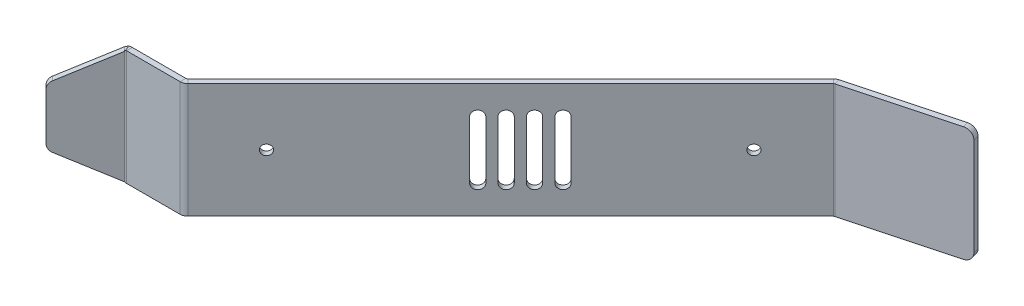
SolidWorks part; units mm, degrees
ref_plane "Plan de face" through (0, 0, 0) normal (0, 0, 1) x (1, 0, 0)
ref_plane "Plan de dessus" through (0, 0, 0) normal (0, 1, 0) x (1, 0, 0)
ref_plane "Plan de droite" through (0, 0, 0) normal (1, 0, 0) x (0, 0, -1)
sketch "Esquisse1" plane through (0, 0, 0) normal (0, 0, 1) x (1, 0, 0)
  line L0 (20, 45) -> (20, -5) construction
  line L1 (20, 0) -> (237, 0)
  line L2 (0, 11.8541) -> (0, 28.1459)
  line L3 (20, 40) -> (237, 40)
  line L4 (240, 3) -> (240, 37)
  line L5 (40, 45) -> (40, -5) construction
  line L6 (200, 45) -> (200, -5) construction
  line L7 (55, 20) -> (185, 20) construction
  line L8 (60, 25) -> (60, 15) construction
  line L9 (180, 25) -> (180, 15) construction
  line L10 (-7.2869, 10) -> (4.241, 10) construction
  line L11 (-7.2869, 30) -> (4.241, 30) construction
  line L12 (1.6584, 9.1708) -> (20, 0)
  line L13 (1.6584, 30.8292) -> (20, 40)
  circle A0 centre (60, 20) radius 1.75
  circle A1 centre (180, 20) radius 1.75
  arc A2 (1.6584, 30.8292) -> (0, 28.1459) centre (3, 28.1459) ccw
  arc A3 (1.6584, 9.1708) -> (0, 11.8541) centre (3, 11.8541) cw
  arc A4 (237, 0) -> (240, 3) centre (237, 3) ccw
  arc A5 (237, 40) -> (240, 37) centre (237, 37) cw
  point P30 (0, 30)
  point P33 (0, 10)
  dimension "D1" = 3
extrude "Extrusion1" add sketch "Esquisse1" along normal blind 2
sketch "Esquisse2" plane through (0, 0, 2) normal (0, 0, 1) x (1, 0, 0)
  line L0 (20, 40) -> (20, 0)
sketch "Esquisse10" plane through (0, 0, 0) normal (0, 0, -1) x (-1, 0, 0)
  line L0 (-179.7363, 30) -> (-88.1801, 30) construction
  line L1 (-176.4242, 10) -> (-88.1801, 10) construction
  line L2 (-133, 45.1957) -> (-133, -8.981) construction
  line L3 (-237, 40) -> (-20, 40) construction
  line L4 (-20, 0) -> (-237, 0) construction
  line L5 (-128, 30) -> (-128, 10)
  line L6 (-135, 30) -> (-135, 10)
  line L7 (-131, 30) -> (-131, 10)
  line L8 (-124, 30) -> (-124, 10)
  line L9 (-121, 30) -> (-121, 10)
  line L10 (-117, 30) -> (-117, 10)
  line L11 (-114, 30) -> (-114, 10)
  line L12 (-110, 30) -> (-110, 10)
  circle A0 centre (-180, 20) radius 1.75 construction
  arc A1 (-135, 30) -> (-131, 30) centre (-133, 30) cw
  arc A2 (-131, 10) -> (-135, 10) centre (-133, 10) cw
  arc A3 (-128, 30) -> (-124, 30) centre (-126, 30) cw
  arc A4 (-124, 10) -> (-128, 10) centre (-126, 10) cw
  arc A5 (-121, 30) -> (-117, 30) centre (-119, 30) cw
  arc A6 (-117, 10) -> (-121, 10) centre (-119, 10) cw
  arc A7 (-114, 30) -> (-110, 30) centre (-112, 30) cw
  arc A8 (-110, 10) -> (-114, 10) centre (-112, 10) cw
  dimension "D3" = 47
  dimension "D1" = 10
  dimension "D2" = 10
extrude "Enlèv. mat.-Extru.1" cut sketch "Esquisse10" against normal blind 10
sheet metal parameters "Tôlerie 1" parameters "D1"=0.7366
flatten bends "Dépliage 1" parameters "D1"=0
sketch "Esquisse-Angle1" plane through (0, 0, 2) normal (0, 0, 1) x (1, 0, 0)
process bends "Pliage 1" parameters "D1"=0
sketch "Esquisse-Plate1" plane through (0, 0, 2) normal (0, 0, 1) x (1, 0, 0)
sketched bend "Pli esquissé1" parameters "D1"=0.7366
bend "Pli esquissé2" bend radius 0.7366 bend angle 45 parameters "D5"=1
sketch "Esquisse8" plane through (0, 0, 0) normal (0, 0, -1) x (-1, 0, 0)
  line L0 (-40, 40) -> (-40, 0)
  line L1 (-237, 40) -> (-20.682, 40) construction
  line L2 (-20.682, 0) -> (-237, 0) construction
  line L3 (-240, 3) -> (-240, 37) construction
  dimension "D1" = 200
sketched bend "Pli esquissé3" parameters "D1"=0.7366
bend "Pli esquissé4" bend radius 0.7366 bend angle 45 parameters "D5"=2
sketch "Esquisse9" plane through (21.2258, 0, 21.2258) normal (0.7071, 0, 0.7071) x (0.7071, 0, -0.7071)
  line L0 (187.6409, 40) -> (187.6409, 0)
  line L1 (224.6409, 40) -> (28.3229, 40) construction
  line L2 (28.3229, 0) -> (224.6409, 0) construction
  circle A0 centre (167.6409, 20) radius 1.75 construction
  dimension "D1" = 20
sketched bend "Pli esquissé5" parameters "D1"=0.7366
bend "Pli esquissé6" bend radius 0.7366 bend angle 30 parameters "D5"=3
flat pattern "Etat déplié1"
sketch "Lignes de pliage1" plane through (21.2258, 0, 21.2258) normal (0.7071, 0, 0.7071) x (0.7071, 0, -0.7071)
  line L0 (177.6409, 0) -> (177.6409, 40) construction
  line L1 (27.6409, 40) -> (27.6409, 0) construction
  line L2 (7.6409, 0) -> (7.6409, 40) construction
bend of the flat pattern "Dépliage-<Pli esquissé2>1"
bend of the flat pattern "Dépliage-<Pli esquissé4>1"
bend of the flat pattern "Dépliage-<Pli esquissé6>1"
